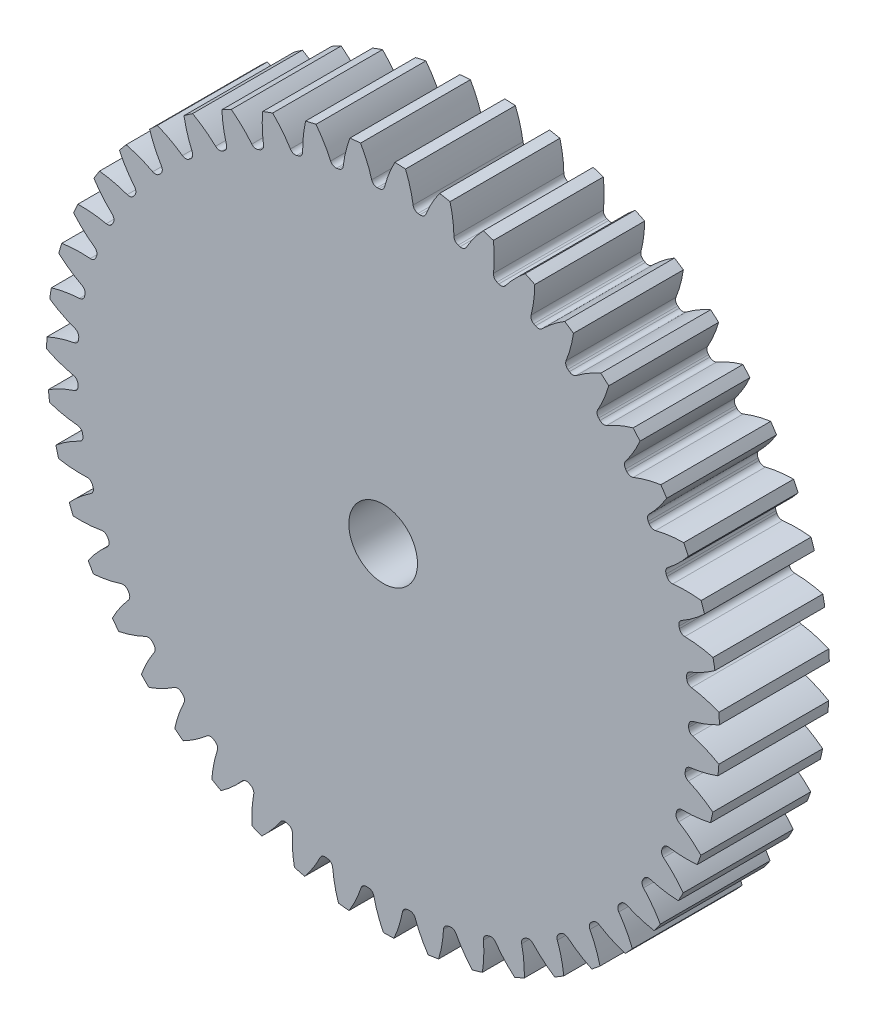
SolidWorks part; units mm, degrees
ref_plane "Front" through (0, 0, 0) normal (0, 0, 1) x (1, 0, 0)
ref_plane "Top" through (0, 0, 0) normal (0, 1, 0) x (1, 0, 0)
ref_plane "Right" through (0, 0, 0) normal (1, 0, 0) x (0, 0, -1)
sketch "Sketch3" plane through (0, 0, 0) normal (0, 0, 1) x (1, 0, 0)
  circle A0 centre (0, 0) radius 311.15
  dimension "od" = 622.3
extrude "gearBody" add sketch "Sketch3" along normal blind 101.6
sketch "Sketch2" plane through (0, 0, 0) normal (0, 0, 1) x (1, 0, 0)
  line L0 (0, 0) -> (259.1032, 107.3241) construction
  line L1 (310.5985, -21.3532) -> (0, 0) construction
  line L2 (0, 0) -> (36.3143, 0) construction
  line L3 (298.4115, 4.7909) -> (298.069, -15.0763) construction
  line L5 (298.2403, -5.1427) -> (0, 0) construction
  line L7 (0, 0) -> (280.4513, 0) construction
  arc A0 (280.451, -0.3907) -> (280.2977, -9.2785) centre (0, 0) ccw construction
  arc A1 (310.9716, 10.5363) -> (310.4234, -21.2513) centre (0, 0) ccw construction
  arc A2 (298.4115, 4.7909) -> (298.069, -15.0763) centre (0, 0) ccw construction
  arc A3 (282.5159, -5.7785) -> (282.5472, -3.9651) centre (0, 0) ccw
  arc A4 (310.5985, -21.3532) -> (286.2256, -10.8431) centre (255.249, -116.1932) ccw
  arc A5 (310.5985, -21.3532) -> (311.15, 10.6322) centre (0, 0) ccw
  arc A6 (311.15, 10.6322) -> (286.4293, 0.9686) centre (259.1032, 107.3241) cw
  arc A7 (282.5472, -3.9651) -> (286.4293, 0.9686) centre (287.7156, -4.0377) cw
  arc A8 (286.2256, -10.8431) -> (282.5159, -5.7785) centre (287.6837, -5.8842) cw
  point P6 (311.15, 10.6322)
  point P22 (310.5985, -21.3532)
  dimension "baseDia" = 560.9025
  dimension "od" = 622.3
  dimension "pd" = 596.9
  dimension "rd" = 565.15
  dimension "rFillet" = 5.1689
  dimension "pointX" = 311.15
  dimension "pointY" = 10.6322
  dimension "CTT" = 19.8672
  dimension "flankCenterAngle" = 22.5
extrude "toothCut" cut sketch "Sketch2" along normal through all
pattern_circular "CirPattern1" count 47 over 360 about axis through (0, 0, 0) along (0, 0, 1) of "toothCut"
sketch "hub1Dia" plane through (0, 0, 0) normal (0, 0, -1) x (-1, 0, 0)
  circle A0 centre (0, 0) radius 12.7
  dimension "hub1Dia" = 25.4
sketch "hub2Dia" plane through (0, 0, 101.6) normal (0, 0, 1) x (1, 0, 0)
  circle A0 centre (0, 0) radius 12.7
  dimension "hub2dia" = 25.4
sketch "boreDia" plane through (0, 0, 0) normal (0, 0, 1) x (1, 0, 0)
  circle A0 centre (0, 0) radius 31.75
  dimension "boreDia" = 63.5
extrude "bore" cut sketch "boreDia" against normal mid plane 25400
